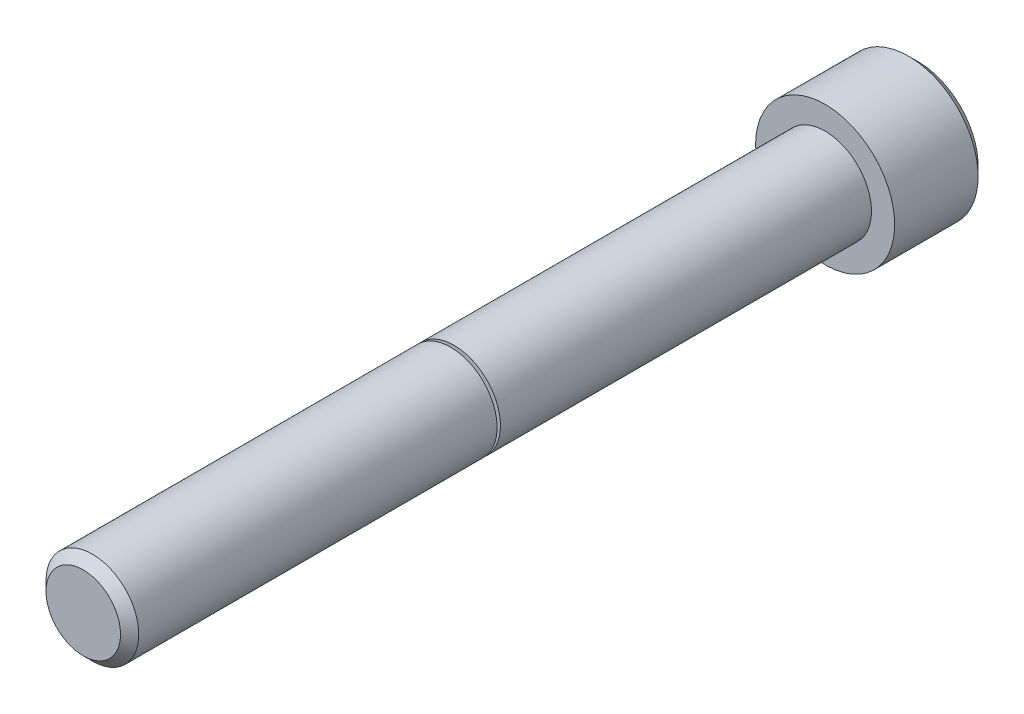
SolidWorks part; units mm, degrees
ref_plane "Front" through (0, 0, 0) normal (0, 0, 1) x (1, 0, 0)
ref_plane "Top" through (0, 0, 0) normal (0, 1, 0) x (1, 0, 0)
ref_plane "Right" through (0, 0, 0) normal (1, 0, 0) x (0, 0, -1)
sketch "Logo3_Revol_Axis" plane through (0, 0, 0) normal (0, 1, 0) x (1, 0, 0)
  line L0 (0, -43.5172) -> (0, 43.5172) construction
sketch "Logo3_bib1" plane through (0, 0, 0) normal (0, -1, 0) x (-1, 0, 0)
  line L0 (0, -50.8) -> (0, 6.35)
  line L1 (0, 6.35) -> (4.1275, 6.35)
  line L2 (4.7625, 5.715) -> (4.7625, 0)
  line L3 (4.7625, 0) -> (3.175, 0)
  line L4 (3.175, 0) -> (3.175, -25.41)
  line L5 (3.175, -50.1777) -> (2.5527, -50.8)
  line L6 (2.5527, -50.8) -> (0, -50.8)
  line L7 (3.175, -25.41) -> (2.6661, -25.41)
  line L8 (2.6593, -25.4488) -> (3.175, -25.6365)
  line L9 (3.175, -25.6365) -> (3.175, -50.1777)
  line L10 (0, 10.5852) -> (0, -63.2873) construction
  line L11 (4.1275, 6.35) -> (4.7625, 5.715)
  arc A1 (2.6661, -25.41) -> (2.6593, -25.4488) centre (2.6661, -25.43) ccw
  point P17 (2.5527, -25.41)
  point P19 (4.7625, 6.35)
revolve "Revolve1" add sketch "Logo3_bib1" angle 360 about L10
sketch "Logo3_bib2" plane through (0, 0, -6.35) normal (0, 0, -1) x (1, 0, 0)
  line L1 (2.7496, 0) -> (1.3748, 2.3813)
  line L2 (1.3748, 2.3813) -> (-1.3748, 2.3813)
  line L3 (-1.3748, 2.3813) -> (-2.7496, 0)
  line L4 (-2.7496, 0) -> (-1.3748, -2.3813)
  line L5 (-1.3748, -2.3813) -> (1.3748, -2.3813)
  line L6 (1.3748, -2.3813) -> (2.7496, 0)
  circle A0 centre (0, 0) radius 2.3812 construction
  dimension "Logo3_c1" = 4.7625
extrude "Cut-Extrude1" cut sketch "Logo3_bib2" against normal blind 3.175
equation "\"DIA2@Logo3_bib1\" = \"Logo3_d1-pas@Logo3_bib1\""
equation "\"LGT1@Logo3_bib1\" = \"Logo3_d1@Logo3_bib1\""
equation "\"D1@Cut-Extrude1\" = \"Logo3_d1@Logo3_bib1\"/2."
equation "\"D2@Cosmetic Thread1\" = \"Logo3_d1-pas@Logo3_bib1\""
equation "\"D5@Logo3_bib1\"=\"Logo3_d1@Logo3_bib1\"*.1"
